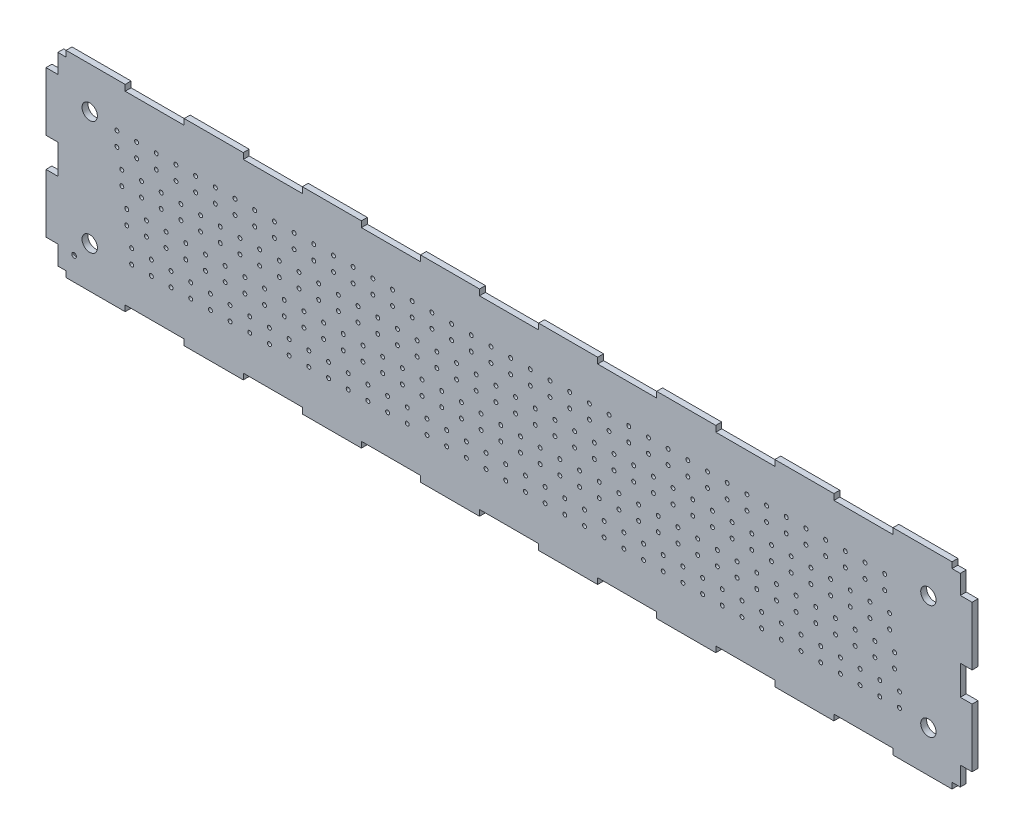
SolidWorks part; units mm, degrees
ref_plane "Alzado" through (0, 0, 0) normal (0, 0, 1) x (1, 0, 0)
ref_plane "Planta" through (0, 0, 0) normal (0, 1, 0) x (1, 0, 0)
ref_plane "Vista lateral" through (0, 0, 0) normal (1, 0, 0) x (0, 0, -1)
sketch "Croquis1" plane through (0, 0, 0) normal (0, 0, 1) x (1, 0, 0)
  line L1 (-229.2, -50) -> (229.2, -50)
  line L2 (-229.2, -50) -> (-229.2, 50)
  line L3 (-229.2, 50) -> (229.2, 50)
  line L4 (229.2, -50) -> (229.2, 50)
  line L5 (-229.2, -50) -> (229.2, 50) construction
  line L6 (-229.2, 50) -> (229.2, -50) construction
  point P0 (0, 0)
  dimension "D1" = 458.4
  dimension "D2" = 100
extrude "Saliente-Extruir1" add sketch "Croquis1" along normal blind 3
sketch "Croquis2" plane through (-229.2, 0, 0) normal (-1, 0, 0) x (0, 0, 1)
  line L0 (3, 50) -> (3, -50) construction
  line L1 (3, 37.3) -> (0, 37.3)
  line L2 (3, 37.3) -> (3, 7.5)
  line L3 (3, 7.5) -> (0, 7.5)
  line L4 (0, 37.3) -> (0, 7.5)
  line L5 (0, 50) -> (0, -50) construction
  line L7 (3, -7.5) -> (0, -7.5)
  line L8 (3, -7.5) -> (3, -37.3)
  line L9 (3, -37.3) -> (0, -37.3)
  line L10 (0, -7.5) -> (0, -37.3)
  dimension "D1" = 7.5
  dimension "D2" = 7.5
  dimension "D3" = 29.8
  dimension "D4" = 29.8
extrude "Saliente-Extruir2" add sketch "Croquis2" along normal blind 6
sketch "Croquis3" plane through (229.2, 0, 0) normal (1, 0, 0) x (0, 0, -1)
  line L0 (-3, -50) -> (-3, 50) construction
  line L1 (-3, -37.3) -> (0, -37.3)
  line L2 (-3, -37.3) -> (-3, -7.5)
  line L3 (-3, -7.5) -> (0, -7.5)
  line L4 (0, -37.3) -> (0, -7.5)
  line L5 (0, -50) -> (0, 50) construction
  line L7 (-3, 7.5) -> (0, 7.5)
  line L8 (-3, 7.5) -> (-3, 37.3)
  line L9 (-3, 37.3) -> (0, 37.3)
  line L10 (0, 7.5) -> (0, 37.3)
  dimension "D1" = 7.5
  dimension "D2" = 7.5
  dimension "D3" = 29.8
  dimension "D4" = 29.8
extrude "Saliente-Extruir3" add sketch "Croquis3" along normal blind 6
sketch "Croquis4" plane through (0, 0, 3) normal (0, 0, 1) x (1, 0, 0)
  line L0 (0, 0) -> (-229.2, 0) construction
  line L1 (-229.2, 7.5) -> (-229.2, -7.5) construction
  line L2 (0, 0) -> (0, 50) construction
  line L3 (229.2, 50) -> (-229.2, 50) construction
  line L4 (-229.2, 50) -> (-229.2, 37.3) construction
  circle A0 centre (-213, 29) radius 3.9
  circle A1 centre (-213, -29) radius 3.9
  circle A2 centre (213, -29) radius 3.9
  circle A3 centre (213, 29) radius 3.9
  point P12 (-229.2, 43.65)
  dimension "D1" = 16.2
  dimension "D2" = 21
  dimension "D3" = 7.8
extrude "Cortar-Extruir1" cut sketch "Croquis4" against normal up to next
sketch "Croquis6" plane through (0, 0, 3) normal (0, 0, 1) x (1, 0, 0)
  line L2 (-199.2, 27.6) -> (-191.7, -20.4) construction
  circle A0 centre (-199.2, 27.6) radius 1
  circle A1 centre (-199.2, 20.4) radius 1
  circle A2 centre (-196.7, 11.6) radius 1
  circle A3 centre (-194.2, -4.4) radius 1
  circle A4 centre (-191.7, -20.4) radius 1
  circle A5 centre (-196.7, 4.4) radius 1
  circle A6 centre (-194.2, -11.6) radius 1
  circle A7 centre (-191.7, -27.6) radius 1
  circle A8 centre (-213, 29) radius 3.9 construction
  dimension "D2" = 1.4
  dimension "D3" = 2
  dimension "D4" = 2
  dimension "D5" = 7.2
  dimension "D6" = 7.5
  dimension "D8" = 7.2
  dimension "D9" = 7.2
  dimension "D10" = 7.2
  dimension "D11" = 2
  dimension "D12" = 2
  dimension "D13" = 2
  dimension "D14" = 2
  dimension "D15" = 2
  dimension "D16" = 2
  dimension "D17" = 16
  dimension "D18" = 16
  dimension "D19" = 13.8
  dimension "D7" = 48
extrude "Cortar-Extruir2" cut sketch "Croquis6" against normal up to next
pattern_linear "MatrizL1" count 40 spacing 10 along (1, 0, 0) of "Cortar-Extruir2"
sketch "Croquis8" plane through (0, -50, 0) normal (0, -1, 0) x (1, 0, 0)
  line L0 (-229.2, 3) -> (229.2, 3) construction
  line L1 (-15, 3) -> (15, 3)
  line L2 (-15, 3) -> (-15, 0)
  line L3 (-15, 0) -> (15, 0)
  line L4 (229.2, 3) -> (229.2, 0)
  line L5 (-229.2, 0) -> (229.2, 0) construction
  line L7 (-45, 3) -> (-75, 3)
  line L8 (-45, 3) -> (-45, 0)
  line L9 (-45, 0) -> (-75, 0)
  line L10 (-75, 3) -> (-75, 0)
  line L11 (-105, 3) -> (-135, 3)
  line L12 (-105, 3) -> (-105, 0)
  line L13 (-105, 0) -> (-135, 0)
  line L14 (-135, 3) -> (-135, 0)
  line L15 (-165, 3) -> (-195, 3)
  line L16 (-165, 3) -> (-165, 0)
  line L17 (-165, 0) -> (-195, 0)
  line L18 (-195, 3) -> (-195, 0)
  line L19 (-225, 3) -> (-229.2, 3)
  line L20 (-225, 3) -> (-225, 0)
  line L21 (-225, 0) -> (-229.2, 0)
  line L22 (-229.2, 3) -> (-229.2, 0)
  line L23 (0, 0) -> (0, 3) construction
  line L24 (225, 0) -> (229.2, 0)
  line L25 (225, 3) -> (225, 0)
  line L26 (225, 3) -> (229.2, 3)
  line L27 (195, 3) -> (195, 0)
  line L28 (165, 0) -> (195, 0)
  line L29 (165, 3) -> (165, 0)
  line L30 (165, 3) -> (195, 3)
  line L31 (135, 3) -> (135, 0)
  line L32 (105, 0) -> (135, 0)
  line L33 (105, 3) -> (105, 0)
  line L34 (105, 3) -> (135, 3)
  line L35 (75, 3) -> (75, 0)
  line L36 (45, 0) -> (75, 0)
  line L37 (45, 3) -> (45, 0)
  line L38 (45, 3) -> (75, 3)
  line L39 (15, 3) -> (15, 0)
  dimension "D1" = 15
  dimension "D2" = 30
  dimension "D3" = 30
  dimension "D4" = 30
  dimension "D5" = 30
  dimension "D6" = 30
  dimension "D7" = 30
  dimension "D8" = 30
extrude "Cortar-Extruir4" cut sketch "Croquis8" against normal blind 3
sketch "Croquis9" plane through (0, 50, 0) normal (0, 1, 0) x (1, 0, 0)
  line B0 (-15, 0) -> (15, 0)
  line B1 (-15, 0) -> (-15, -3)
  line B2 (-15, -3) -> (15, -3)
  line B3 (229.2, 0) -> (229.2, -3)
  line B4 (-45, 0) -> (-75, 0)
  line B5 (-45, 0) -> (-45, -3)
  line B6 (-45, -3) -> (-75, -3)
  line B7 (-75, 0) -> (-75, -3)
  line B8 (-105, 0) -> (-135, 0)
  line B9 (-105, 0) -> (-105, -3)
  line B10 (-105, -3) -> (-135, -3)
  line B11 (-135, 0) -> (-135, -3)
  line B12 (-165, 0) -> (-195, 0)
  line B13 (-165, 0) -> (-165, -3)
  line B14 (-165, -3) -> (-195, -3)
  line B15 (-195, 0) -> (-195, -3)
  line B16 (-225, 0) -> (-229.2, 0)
  line B17 (-225, 0) -> (-225, -3)
  line B18 (-225, -3) -> (-229.2, -3)
  line B19 (-229.2, 0) -> (-229.2, -3)
  line B20 (0, -3) -> (0, 0) construction
  line B21 (225, -3) -> (229.2, -3)
  line B22 (225, 0) -> (225, -3)
  line B23 (225, 0) -> (229.2, 0)
  line B24 (195, 0) -> (195, -3)
  line B25 (165, -3) -> (195, -3)
  line B26 (165, 0) -> (165, -3)
  line B27 (165, 0) -> (195, 0)
  line B28 (135, 0) -> (135, -3)
  line B29 (105, -3) -> (135, -3)
  line B30 (105, 0) -> (105, -3)
  line B31 (105, 0) -> (135, 0)
  line B32 (75, 0) -> (75, -3)
  line B33 (45, -3) -> (75, -3)
  line B34 (45, 0) -> (45, -3)
  line B35 (45, 0) -> (75, 0)
  line B36 (15, 0) -> (15, -3)
sketch_block_instance "Bloque1-1"
sketch_block "Bloque1"
extrude "Cortar-Extruir5" cut sketch "Croquis9" against normal blind 3
sketch "Croquis10" plane through (0, 0, 3) normal (0, 0, 1) x (1, 0, 0)
  circle A0 centre (-220.9109, -38.1386) radius 1.192
extrude "Cortar-Extruir6" cut sketch "Croquis10" against normal blind 1
